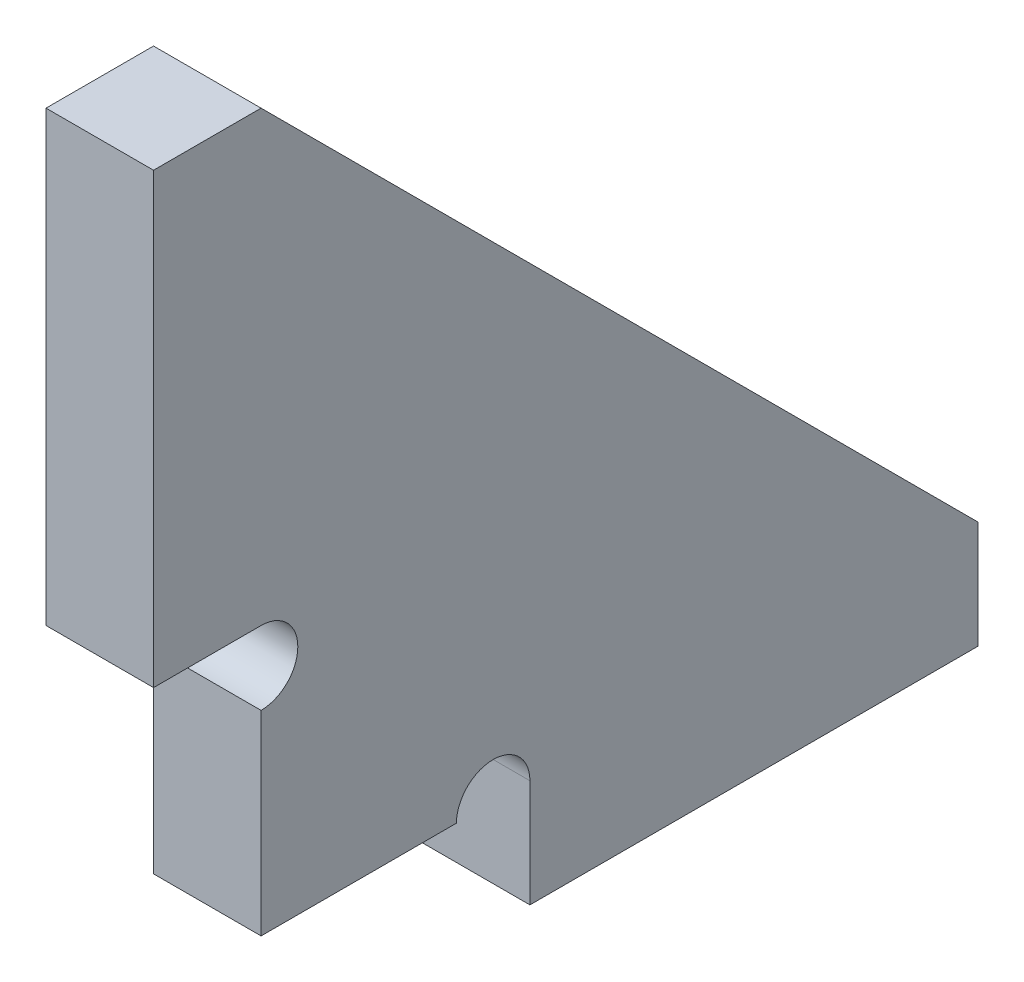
SolidWorks part; units mm, degrees
ref_plane "Спереди" through (0, 0, 0) normal (0, 0, 1) x (1, 0, 0)
ref_plane "Сверху" through (0, 0, 0) normal (0, 1, 0) x (1, 0, 0)
ref_plane "Справа" through (0, 0, 0) normal (1, 0, 0) x (0, 0, -1)
sketch "Sketch1" plane through (0, 0, 0) normal (1, 0, 0) x (0, 0, -1)
  line L0 (0, 0) -> (-50, 0)
  line L1 (-50, 0) -> (-50, 12)
  line L2 (-58.2, 12) -> (-80, 12)
  line L3 (-80, 12) -> (-80, 33.8)
  line L4 (-80, 42) -> (-92, 42)
  line L5 (-92, 42) -> (-92, 92)
  line L6 (-92, 92) -> (-80, 92)
  line L7 (-80, 92) -> (0, 12)
  line L8 (0, 12) -> (0, 0)
  arc A0 (-80, 42) -> (-80, 33.8) centre (-80, 37.9) cw
  arc A1 (-50, 12) -> (-58.2, 12) centre (-54.1, 12) ccw
  dimension "D4" = 4.1
  dimension "D5" = 4.1
  dimension "D1" = 30
  dimension "D2" = 50
  dimension "D3" = 12
extrude "Boss-Extrude1" add sketch "Sketch1" along normal blind 12
sketch3d "Sketch_MAC1-1_ОГРАНИЧИТЕЛЬ_MILLING" [suppressed]
  line L0 (12, 0, 0) -> (12, 10, 0)
  line L1 (12, 0, 0) -> (12, 0, 10)
  point P0 (12, 0, 0)
  point P1 (12, 10, 0)
  point P2 (12, 0, 10)
sketch3d "Stock_ОГРАНИЧИТЕЛЬ_MILLING"
  line L0 (0, 0, 0) -> (0, 92, 0)
  line L1 (0, 92, 0) -> (0, 92, 92)
  line L2 (0, 92, 92) -> (0, 0, 92)
  line L3 (0, 0, 92) -> (0, 0, 0)
  line L4 (12, 0, 0) -> (12, 92, 0)
  line L5 (12, 92, 0) -> (12, 92, 92)
  line L6 (12, 92, 92) -> (12, 0, 92)
  line L7 (12, 0, 92) -> (12, 0, 0)
  line L8 (0, 0, 0) -> (12, 0, 0)
  line L9 (0, 92, 0) -> (12, 92, 0)
  line L10 (0, 92, 92) -> (12, 92, 92)
  line L11 (0, 0, 92) -> (12, 0, 92)
  point P8 (0, 46, 0)
  point P9 (0, 92, 46)
  point P10 (0, 46, 92)
  point P11 (0, 0, 46)
  point P12 (12, 46, 0)
  point P13 (12, 92, 46)
  point P14 (12, 46, 92)
  point P15 (12, 0, 46)
  point P16 (6, 0, 0)
  point P17 (6, 92, 0)
  point P18 (6, 92, 92)
  point P19 (6, 0, 92)
  point P20 (6, 46, 46)
  point P21 (6, 46, 0)
  point P22 (12, 46, 46)
  point P23 (6, 46, 92)
  point P24 (0, 46, 46)
  point P25 (6, 0, 46)
  point P26 (6, 92, 46)
